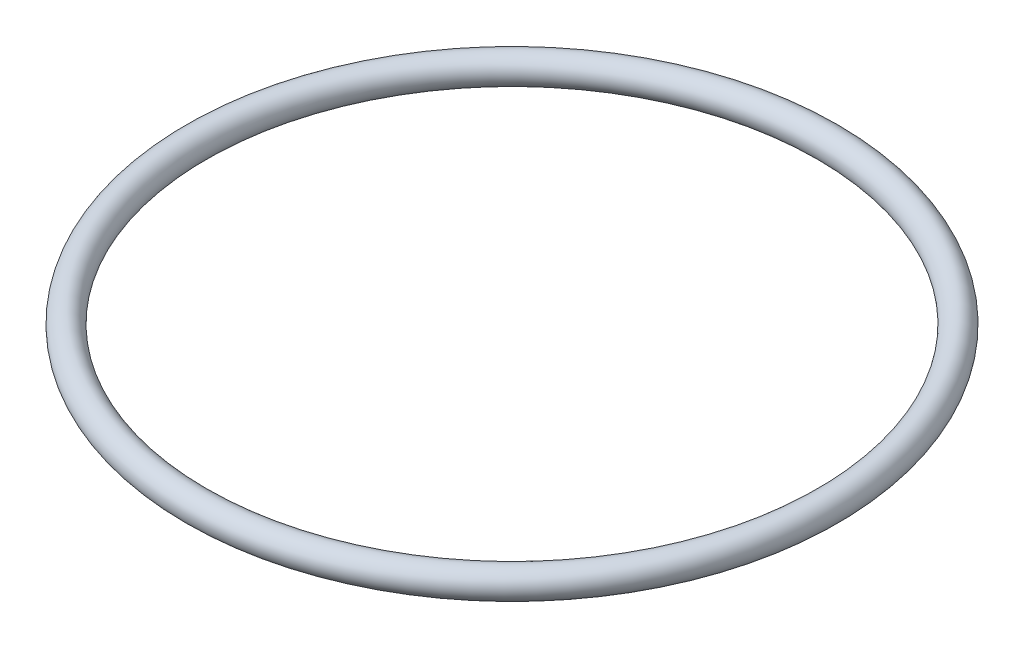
SolidWorks part; units mm, degrees
ref_plane "Front Plane" through (0, 0, 0) normal (0, 0, 1) x (1, 0, 0)
ref_plane "Top Plane" through (0, 0, 0) normal (0, 1, 0) x (1, 0, 0)
ref_plane "Right Plane" through (0, 0, 0) normal (1, 0, 0) x (0, 0, -1)
sketch "Sketch1" plane through (0, 0, 0) normal (0, 0, 1) x (1, 0, 0)
  line L0 (0, 3.7249) -> (0, 0) construction
  line L1 (0, 0) -> (18.9103, 0) construction
  circle A0 centre (19.7993, 0) radius 0.889
  dimension "D1" = 1.778
  dimension "D2" = 37.8206
revolve "Revolve1" add sketch "Sketch1" angle 360 about L0
